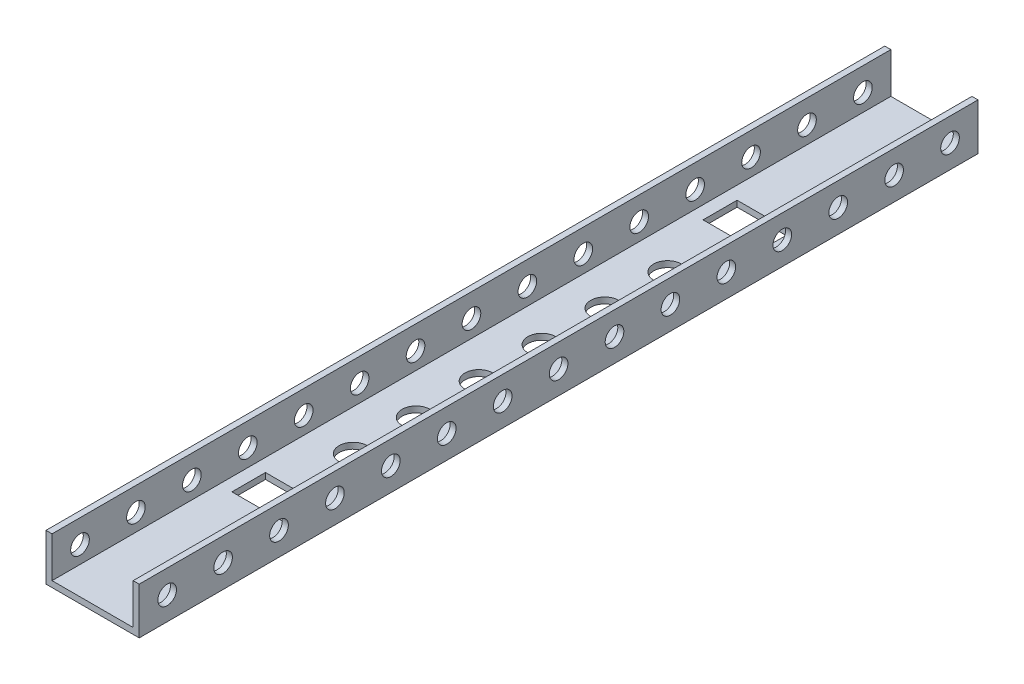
SolidWorks part; units mm, degrees
ref_plane "Front Plane" through (0, 0, 0) normal (0, 0, 1) x (1, 0, 0)
ref_plane "Top Plane" through (0, 0, 0) normal (0, 1, 0) x (1, 0, 0)
ref_plane "Right Plane" through (0, 0, 0) normal (1, 0, 0) x (0, 0, -1)
sketch "Sketch2" plane through (0, 0, 0) normal (0, 0, 1) x (1, 0, 0)
  line L0 (27.8692, -18.1107) -> (27.8692, 7.2893)
  line L1 (-22.9308, -18.1107) -> (-22.9308, 7.2893)
  line L2 (27.8692, 7.2893) -> (24.5672, 7.2893)
  line L3 (24.5672, 7.2893) -> (24.5672, -14.8087)
  line L4 (24.5672, -14.8087) -> (-19.6288, -14.8087)
  line L5 (-22.9308, 7.2893) -> (-19.6288, 7.2893)
  line L6 (-19.6288, 7.2893) -> (-19.6288, -14.8087)
  line L7 (-22.9308, -18.1107) -> (27.8692, -18.1107)
  dimension "D1" = 50.8
  dimension "D2" = 25.4
  dimension "D3" = 3.302
  dimension "D4" = 3.302
  dimension "D5" = 3.302
  dimension "D6" = 25.4
extrude "Boss-Extrude1" add sketch "Sketch2" along normal blind 457.2
sketch "Sketch3" plane through (27.8692, 0, 0) normal (1, 0, 0) x (0, 0, -1)
  circle A0 centre (-228.6, -5.4107) radius 5.08
  dimension "D1" = 10.16
extrude "Cut-Extrude1" cut sketch "Sketch3" against normal blind 88.9
sketch "Sketch4" plane through (27.8692, 0, 0) normal (1, 0, 0) x (0, 0, -1)
  line L0 (-457.2, -18.1107) -> (-457.2, 7.2893) construction
  circle A0 centre (-259.08, -5.4107) radius 5.08
  circle A1 centre (-289.56, -5.4107) radius 5.08
  circle A2 centre (-320.04, -5.4107) radius 5.08
  circle A3 centre (-350.52, -5.4107) radius 5.08
  circle A4 centre (-381, -5.4107) radius 5.08
  circle A5 centre (-411.48, -5.4107) radius 5.08
  circle A6 centre (-198.12, -5.4107) radius 5.08
  circle A7 centre (-167.64, -5.4107) radius 5.08
  circle A8 centre (-137.16, -5.4107) radius 5.08
  circle A9 centre (-106.68, -5.4107) radius 5.08
  circle A10 centre (-76.2, -5.4107) radius 5.08
  circle A11 centre (-45.72, -5.4107) radius 5.08
  circle A12 centre (-228.6, -5.4107) radius 5.08 construction
  circle A13 centre (-441.96, -5.4107) radius 5.08
  circle A14 centre (-15.24, -5.4107) radius 5.08
  dimension "D1" = 10.16
  dimension "D2" = 10.16
  dimension "D3" = 10.16
  dimension "D4" = 10.16
  dimension "D5" = 10.16
  dimension "D6" = 10.16
  dimension "D7" = 10.16
  dimension "D8" = 10.16
  dimension "D9" = 10.16
  dimension "D10" = 10.16
  dimension "D11" = 10.16
  dimension "D12" = 10.16
  dimension "D13" = 30.48
  dimension "D19" = 30.48
  dimension "D25" = 10.16
  dimension "D26" = 30.48
  dimension "D28" = 10.16
  dimension "D29" = 30.48
  dimension "D14" = 30.48
  dimension "D15" = 30.48
  dimension "D16" = 30.48
  dimension "D17" = 30.48
  dimension "D18" = 30.48
  dimension "D20" = 30.48
  dimension "D21" = 30.48
  dimension "D22" = 30.48
  dimension "D23" = 30.48
  dimension "D24" = 30.48
  dimension "D27" = 15.24
extrude "Cut-Extrude2" cut sketch "Sketch4" against normal blind 88.9
sketch "Sketch5" plane through (0, -14.8087, 0) normal (0, 1, 0) x (1, 0, 0)
  line L0 (90.7673, -90.932) -> (-146.8667, -90.932) construction
  line L1 (24.5672, 0) -> (-19.6288, 0) construction
  line L2 (-19.6288, -457.2) -> (-19.6288, 0) construction
  line L3 (-12.5168, -90.932) -> (17.4552, -90.932)
  line L4 (-12.5168, -90.932) -> (-12.5168, -109.474)
  line L5 (-12.5168, -109.474) -> (17.4552, -109.474)
  line L6 (17.4552, -90.932) -> (17.4552, -109.474)
  dimension "D1" = 90.932
  dimension "D2" = 18.542
  dimension "D3" = 29.972
  dimension "D4" = 7.112
extrude "Cut-Extrude3" cut sketch "Sketch5" against normal blind 88.9
sketch "Sketch6" plane through (0, -14.8087, 0) normal (0, 1, 0) x (1, 0, 0)
  line L0 (-134.983, -366.268) -> (216.5233, -366.268) construction
  line L1 (24.5672, -457.2) -> (-19.6288, -457.2) construction
  line L2 (-19.6288, -457.2) -> (-19.6288, 0) construction
  line L3 (-12.5168, -366.268) -> (17.4552, -366.268)
  line L4 (-12.5168, -366.268) -> (-12.5168, -347.98)
  line L5 (-12.5168, -347.98) -> (17.4552, -347.98)
  line L6 (17.4552, -366.268) -> (17.4552, -347.98)
  dimension "D1" = 90.932
  dimension "D2" = 18.288
  dimension "D3" = 29.972
  dimension "D4" = 7.112
extrude "Cut-Extrude4" cut sketch "Sketch6" against normal blind 243.332
sketch "Sketch7" plane through (0, -14.8087, 0) normal (0, 1, 0) x (1, 0, 0)
  line L0 (-12.5168, -109.474) -> (17.4552, -109.474) construction
  circle A0 centre (2.4692, -143.764) radius 7.62
  circle A1 centre (2.4692, -178.054) radius 7.62
  circle A2 centre (2.4692, -212.344) radius 7.62
  circle A3 centre (2.4692, -246.634) radius 7.62
  circle A4 centre (2.4692, -280.924) radius 7.62
  circle A5 centre (2.4692, -315.214) radius 7.62
  dimension "D1" = 15.24
  dimension "D2" = 15.24
  dimension "D3" = 15.24
  dimension "D4" = 15.24
  dimension "D5" = 15.24
  dimension "D6" = 15.24
  dimension "D7" = 34.29
  dimension "D8" = 34.29
  dimension "D9" = 34.29
  dimension "D10" = 34.29
  dimension "D11" = 34.29
  dimension "D12" = 34.29
extrude "Cut-Extrude5" cut sketch "Sketch7" against normal blind 152.4
